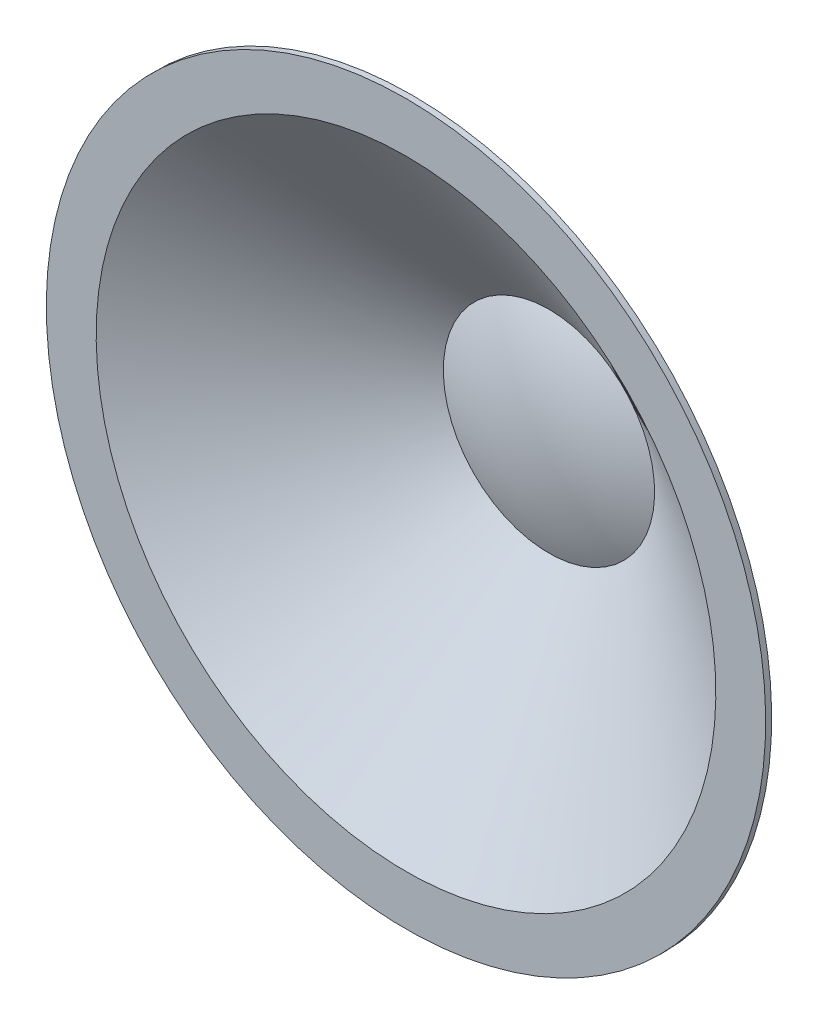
SolidWorks part; units mm, degrees
ref_plane "Front" through (0, 0, 0) normal (0, 0, 1) x (1, 0, 0)
ref_plane "Top" through (0, 0, 0) normal (0, 1, 0) x (1, 0, 0)
ref_plane "Right" through (0, 0, 0) normal (1, 0, 0) x (0, 0, -1)
sketch "Sketch1" plane through (0, 0, 0) normal (1, 0, 0) x (0, 0, -1)
  line L0 (0, 30) -> (0, 26)
  line L1 (0, 26) -> (12, 8.8622)
  line L2 (12, 8.8622) -> (12, 0) construction
  line L3 (12, 0) -> (0, 0) construction
  line L4 (10, 0) -> (10, -2.3819) construction
  arc A0 (12, 8.8622) -> (10, 0) centre (30.6348, 0) ccw
  dimension "D1" = 30
  dimension "D2" = 145
  dimension "D3" = 12
  dimension "D4" = 4
  dimension "D5" = 2
revolve "Revolve-Thin1" add sketch "Sketch1" angle 360 about L3
fillet "Fillet1" radius 1 1 edges at (0, 26, 0)
scale "Scale1" scale about centroid uniform scaling yes scale factor 2
